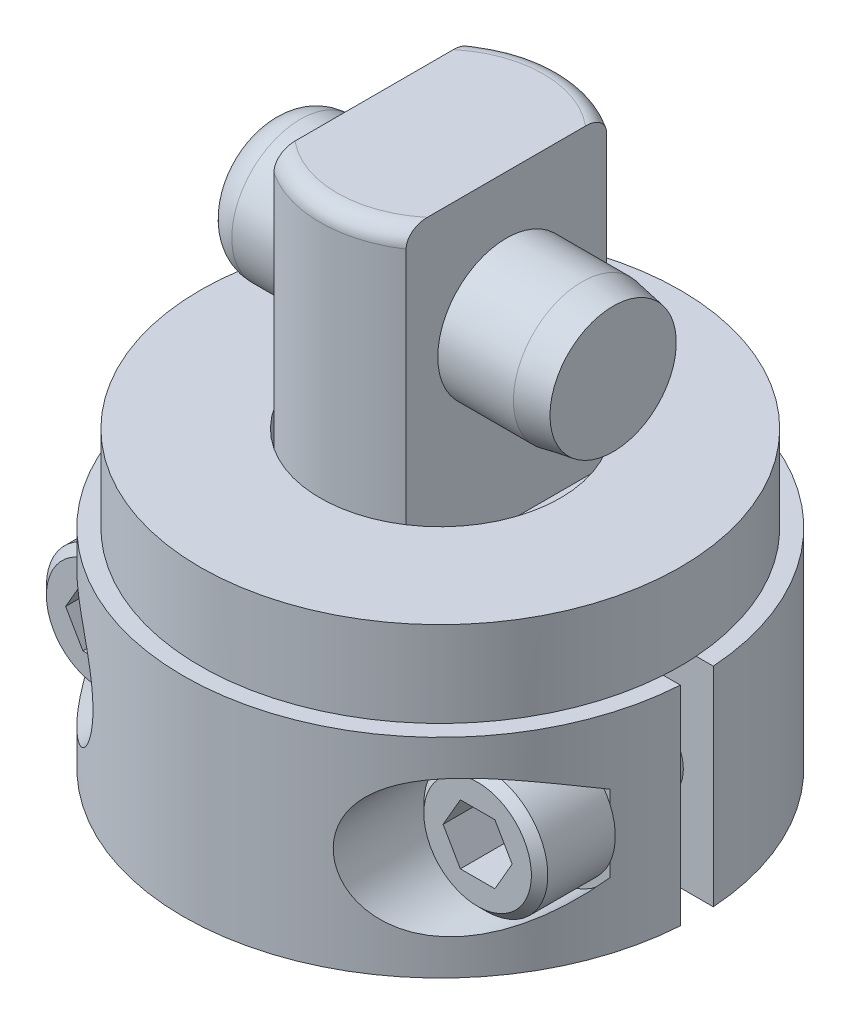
SolidWorks part; units mm, degrees
ref_plane "Front Plane" through (0, 0, 0) normal (0, 0, 1) x (1, 0, 0)
ref_plane "Top Plane" through (0, 0, 0) normal (0, 1, 0) x (1, 0, 0)
ref_plane "Right Plane" through (0, 0, 0) normal (1, 0, 0) x (0, 0, -1)
sketch "Sketch1" plane through (0, 0, 0) normal (1, 0, 0) x (0, 0, -1)
  line L0 (0, 20.6248) -> (5.5626, 20.6248)
  line L1 (5.5626, 20.6248) -> (5.5626, 0)
  line L2 (5.5626, 0) -> (3.175, 0)
  line L3 (3.175, 0) -> (3.175, -6.35)
  line L4 (3.175, -6.35) -> (0, -6.35)
  line L5 (0, -6.35) -> (0, 20.6248)
  line L6 (0, -15.3594) -> (0, 43.147) construction
  dimension "D1" = 26.9748
  dimension "D2" = 6.35
  dimension "D3" = 6.35
  dimension "D4" = 11.1252
revolve "Revolve1" add sketch "Sketch1" angle 360 about L6
fillet "Fillet1" radius 0.7874 1 edges at (0, 20.6248, -5.5626)
sketch "Sketch2" plane through (0, 0, 0) normal (0, 0, 1) x (1, 0, 0)
  line L0 (3.0607, 20.6248) -> (5.5626, 20.6248)
  line L1 (5.5626, 20.6248) -> (5.5626, 6.5532)
  line L2 (5.5626, 6.5532) -> (3.0607, 6.5532)
  line L3 (3.0607, 6.5532) -> (3.0607, 20.6248)
  line L4 (-5.5626, 20.6248) -> (-3.0607, 20.6248)
  line L5 (-3.0607, 20.6248) -> (-3.0607, 6.5532)
  line L6 (-3.0607, 6.5532) -> (-5.5626, 6.5532)
  line L7 (-5.5626, 6.5532) -> (-5.5626, 20.6248)
  line L8 (0, 5.9766) -> (0, 42.131) construction
  line L9 (4.7752, 20.6248) -> (-4.7752, 20.6248) construction
  line L10 (5.5626, 0) -> (5.5626, 19.8374) construction
  line L11 (-5.5626, 19.8374) -> (-5.5626, 0) construction
  dimension "D1" = 6.1214
  dimension "D2" = 14.0716
extrude "Cut-Extrude1" cut sketch "Sketch2" against normal through all and the other way through all
sketch "Sketch3" plane through (0, 0, 0) normal (0, -1, 0) x (1, 0, 0)
  circle A0 centre (0, 0) radius 2.5781
  circle A1 centre (0, 0) radius 3.175 construction
  circle A2 centre (0, 0) radius 3.175
  dimension "D1" = 5.1562
extrude "Cut-Extrude2" cut sketch "Sketch3" along normal blind 2.54
chamfer "Chamfer1" distance 0.762 angle 45 1 edges at (0, -6.35, -3.175)
sketch "Sketch4" plane through (0, 0, 0) normal (1, 0, 0) x (0, 0, -1)
  line L0 (-5.5626, 0) -> (5.5626, 0) construction
  circle A0 centre (0, 14.7828) radius 3.1775
  dimension "D1" = 6.3551
  dimension "D2" = 14.7828
extrude "Extrude1" add sketch "Sketch4" along normal mid plane 16.002
chamfer "Chamfer2" distance 0.254 angle 80 1 edges at (8.001, 14.7828, -3.1775)
fillet "Fillet2" radius 1.524 1 edges at (-8.001, 14.7828, -3.1775)
sketch "Sketch5" plane through (0, 0, 0) normal (0, 1, 0) x (1, 0, 0)
  line L0 (5.5102, 0.762) -> (11.8755, 0.762)
  line L1 (5.5102, -0.762) -> (11.8755, -0.762)
  line L2 (-5.5102, -0.762) -> (-11.8755, -0.762)
  line L3 (-5.5102, 0.762) -> (-11.8755, 0.762)
  line L4 (0, 0) -> (24.3028, 0) construction
  arc A0 (11.8755, 0.762) -> (-11.8755, 0.762) centre (0, 0) ccw
  arc A1 (-11.8755, -0.762) -> (11.8755, -0.762) centre (0, 0) ccw
  arc A2 (5.5102, 0.762) -> (-5.5102, 0.762) centre (0, 0) ccw
  arc A3 (-5.5102, -0.762) -> (5.5102, -0.762) centre (0, 0) ccw
  circle A4 centre (0, 0) radius 5.5626 construction
  dimension "D2" = 11.8999
  dimension "D1" = 1.524
extrude "Extrude2" add sketch "Sketch5" along normal blind 4.826 and the other way blind 4.826
sketch "Sketch6" plane through (0, 0, 0.762) normal (0, 0, 1) x (1, 0, 0)
  line L0 (0, -5.6718) -> (0, 5.6718) construction
  line L1 (-11.8755, -4.826) -> (11.8755, -4.826) construction
  circle A0 centre (8.7376, 0) radius 3.175
  circle A1 centre (-8.7376, 0) radius 3.175
  dimension "D1" = 6.35
  dimension "D2" = 17.4752
  dimension "D3" = 4.826
extrude "Cut-Extrude3" cut sketch "Sketch6" along normal through all from offset 2.7432
sketch "Sketch7" plane through (0, 0, 3.5052) normal (0, 0, 1) x (1, 0, 0)
  circle A0 centre (8.7376, 0) radius 2.8702
  circle A1 centre (-8.7376, 0) radius 2.8702
  arc A3 (-11.3719, -1.7722) -> (-11.3719, 1.7722) centre (-8.7376, 0) ccw construction
  arc A4 (11.3719, 1.7722) -> (11.3719, -1.7722) centre (8.7376, 0) ccw construction
  dimension "D1" = 5.7404
extrude "Extrude3" add sketch "Sketch7" along normal blind 3.5052
chamfer "Chamfer3" distance 0.381 angle 45 2 edges at (-5.8674, 0, 7.0104) (11.6078, 0, 7.0104)
sketch "Sketch8" plane through (0, 0, 7.0104) normal (0, 0, 1) x (1, 0, 0)
  line L0 (0, 0) -> (0, -21.769) construction
  line L1 (9.5368, 1.3843) -> (10.3361, 0)
  line L2 (7.9384, 1.3843) -> (9.5368, 1.3843)
  line L3 (7.1391, 0) -> (7.9384, 1.3843)
  line L4 (7.9384, -1.3843) -> (7.1391, 0)
  line L5 (9.5368, -1.3843) -> (7.9384, -1.3843)
  line L6 (10.3361, 0) -> (9.5368, -1.3843)
  line L8 (-10.3361, 0) -> (-9.5368, -1.3843)
  line L9 (-9.5368, -1.3843) -> (-7.9384, -1.3843)
  line L10 (-7.9384, -1.3843) -> (-7.1391, 0)
  line L11 (-7.1391, 0) -> (-7.9384, 1.3843)
  line L12 (-7.9384, 1.3843) -> (-9.5368, 1.3843)
  line L13 (-9.5368, 1.3843) -> (-10.3361, 0)
  circle A0 centre (-8.7376, 0) radius 1.3843 construction
  circle A1 centre (8.7376, 0) radius 1.3843 construction
  dimension "D2" = 2.7686
extrude "Cut-Extrude4" cut sketch "Sketch8" against normal blind 2.7686
sketch "Sketch10" plane through (0, 0, 0) normal (0, 0, 1) x (1, 0, 0)
  circle A0 centre (8.7376, 0) radius 1.7526
  circle A1 centre (-8.7376, 0) radius 1.7526
  circle A2 centre (-8.7376, 0) radius 2.8702 construction
  circle A3 centre (8.7376, 0) radius 2.8702 construction
  dimension "D1" = 3.5052
extrude "Extrude4" add sketch "Sketch10" along normal up to next and the other way up to next
sketch "Sketch11" plane through (0, 4.826, 0) normal (0, 1, 0) x (-1, 0, 0)
  circle A0 centre (0, 0) radius 11.1125
  circle A1 centre (0, 0) radius 5.5626
  circle A3 centre (0, 0) radius 3.175 construction
  dimension "D1" = 22.225
  dimension "D2" = 11.1252
extrude "Extrude5" add sketch "Sketch11" along normal blind 3.9624
